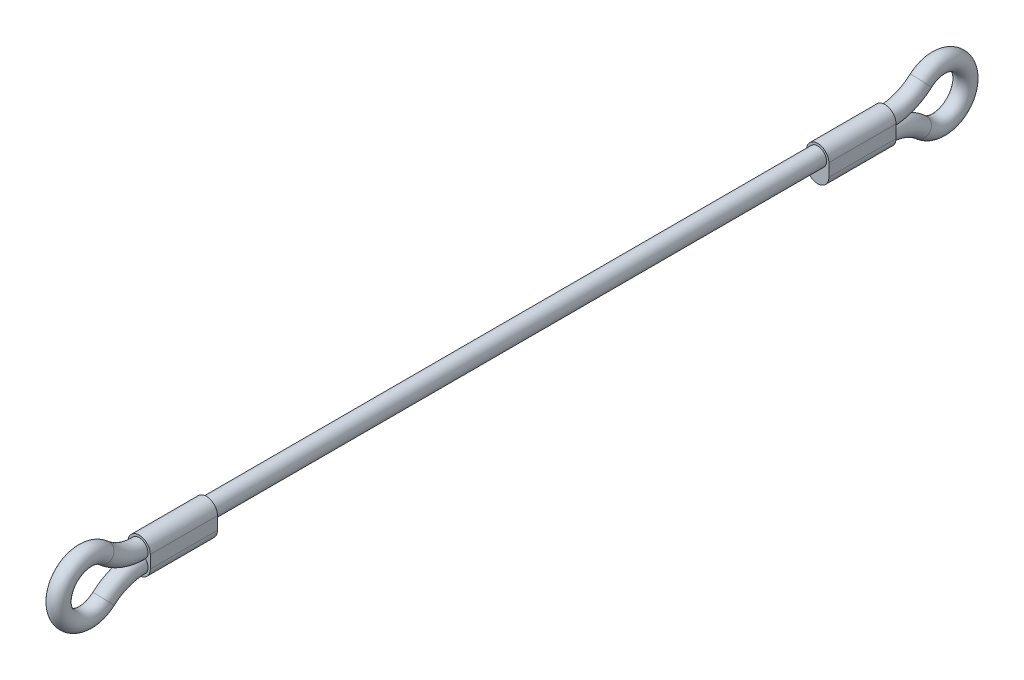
SolidWorks part; units mm, degrees
ref_plane "Front Plane" through (0, 0, 0) normal (0, 0, 1) x (1, 0, 0)
ref_plane "Top Plane" through (0, 0, 0) normal (0, 1, 0) x (1, 0, 0)
ref_plane "Right Plane" through (0, 0, 0) normal (1, 0, 0) x (0, 0, -1)
sketch "Sketch1" plane through (0, 0, 0) normal (1, 0, 0) x (0, 0, -1)
  line L0 (66.6, 0) -> (-66.6, 0)
  line L1 (0, 2.1945) -> (0, -2.1945) construction
  arc A0 (-66.6, 0) -> (-73, 2.4446) centre (-66.6, 9.6) cw
  arc A1 (-73, 2.4446) -> (-73, -4.7108) centre (-76.2, -1.1331) ccw
  arc A2 (-73, -4.7108) -> (-66.6, -2.2663) centre (-66.6, -11.8663) cw
  arc A3 (73, -4.7108) -> (66.6, -2.2663) centre (66.6, -11.8663) ccw
  arc A4 (73, 2.4446) -> (73, -4.7108) centre (76.2, -1.1331) cw
  arc A5 (66.6, 0) -> (73, 2.4446) centre (66.6, 9.6) ccw
  point P18 (0, 0)
  dimension "D1" = 4.8
  dimension "D4" = 9.6
  dimension "D2" = 76.2
  dimension "D3" = 9.6
sketch "Sketch2" plane through (0, 0, 0) normal (0, 0, 1) x (1, 0, 0)
  circle A0 centre (0, 0) radius 1.59
  dimension "D1" = 3.18
sweep "Sweep1" add profiles "Sketch2" path "Sketch1"
sketch "Sketch3" plane through (0, 0, 66.6) normal (0, 0, -1) x (-1, 0, 0)
  line L0 (0, 0) -> (0, -2.2663) construction
  line L1 (1.995, 0) -> (1.995, -2.2663)
  line L2 (-1.995, 0) -> (-1.995, -2.2663)
  line L3 (-1.59, -2.2663) -> (1.59, -2.2663) construction
  arc A0 (1.995, 0) -> (-1.995, 0) centre (0, 0) ccw
  arc A1 (-1.995, -2.2663) -> (1.995, -2.2663) centre (0, -2.2663) ccw
  point P3 (0, -1.1331)
  dimension "D1" = 3.99
extrude "Boss-Extrude1" add sketch "Sketch3" along normal blind 12
mirror "Mirror1" about plane through (0, 0, 0) normal (0, 0, 1) of "Boss-Extrude1"
